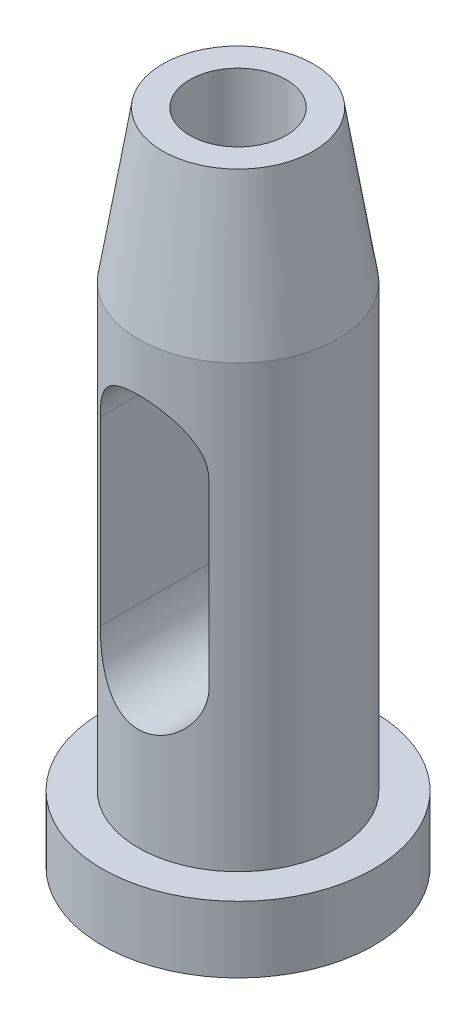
SolidWorks part; units mm, degrees
ref_plane "Front" through (0, 0, 0) normal (0, 0, 1) x (1, 0, 0)
ref_plane "Top" through (0, 0, 0) normal (0, 1, 0) x (1, 0, 0)
ref_plane "Right" through (0, 0, 0) normal (1, 0, 0) x (0, 0, -1)
sketch "Sketch4" plane through (0, 0, 0) normal (0, 0, 1) x (1, 0, 0)
  line L0 (0, 0) -> (0, 104.0793) construction
  line L1 (0, 0) -> (22.5, 0)
  line L2 (22.5, 0) -> (22.5, 11)
  line L3 (22.5, 11) -> (16.5, 11)
  line L4 (16.5, 11) -> (16.5, 84)
  line L5 (16.5, 84) -> (12.5, 109)
  line L6 (12.5, 109) -> (0, 109)
  line L7 (0, 109) -> (0, 0)
  dimension "D1" = 45
  dimension "D2" = 33
  dimension "D3" = 25
  dimension "D4" = 11
  dimension "D5" = 109
  dimension "D6" = 25
revolve "Revolve1" add sketch "Sketch4" angle 360 about L0
sketch "Sketch5" plane through (0, 0, 0) normal (0, 0, 1) x (1, 0, 0)
  line L0 (0, 0) -> (0, 113.2902) construction
  line L1 (9, 37) -> (9, 67)
  line L2 (-9, 67) -> (-9, 37)
  line L3 (22.5, 11) -> (-22.5, 11) construction
  arc A0 (-9, 37) -> (9, 37) centre (0, 37) ccw
  arc A1 (9, 67) -> (-9, 67) centre (0, 67) ccw
  dimension "D3" = 9
  dimension "D1" = 26
  dimension "D2" = 30
extrude "Cut-Extrude1" cut sketch "Sketch5" against normal through all and the other way through all
hole_wizard "M16.0 (16.000000) Diameter Hole1" positions "Sketch7" profile "Sketch6" hole size "M16.0" standard "Ansi Metric"
sketch "Sketch7" plane through (0, 109, 0) normal (0, 1, 0) x (-1, 0, 0)
  circle A0 centre (0, 0) radius 12.5 construction
  point P0 (0, 0)
sketch "Sketch6" plane through (0, 109, 0) normal (1, 0, 0) x (0, 0, 1)
  line L0 (0, 0) -> (0, 46.8069)
  line L1 (0, 46.8069) -> (8, 42)
  line L2 (8, 42) -> (8, 0)
  line L5 (8, 0) -> (0, 0)
  line L10 (0, 46.8069) -> (-8, 42) construction
  line L11 (0, -6.35) -> (0, 107.95) construction
  dimension "Hole Dia." = 16
  dimension "Hole Depth" = 42
  dimension "Drill Angle" = 118
